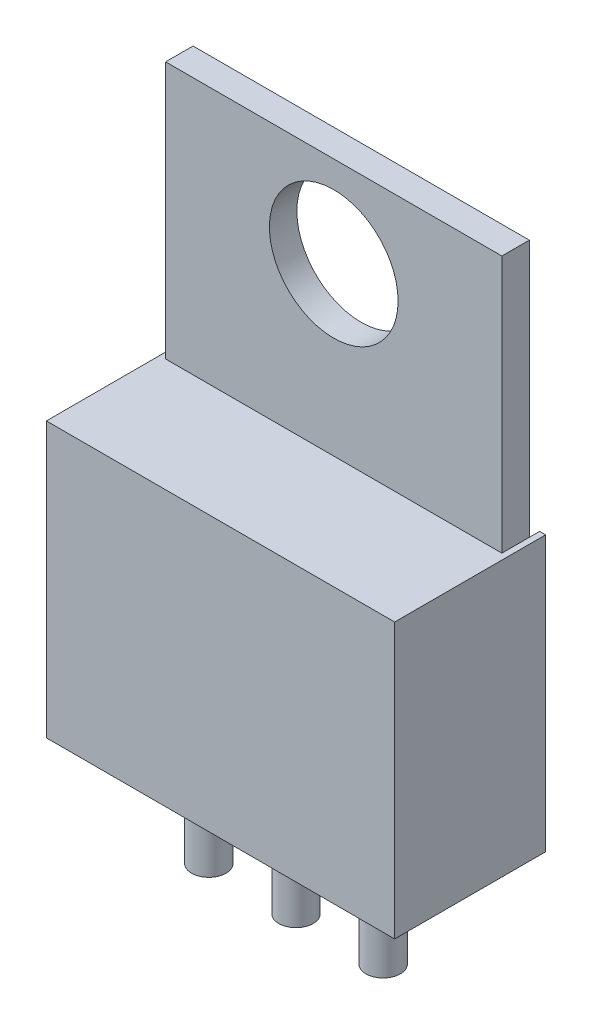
SolidWorks part; units mm, degrees
ref_plane "Face" through (0, 0, 0) normal (0, 0, 1) x (1, 0, 0)
ref_plane "Dessus" through (0, 0, 0) normal (0, 1, 0) x (1, 0, 0)
ref_plane "Droite" through (0, 0, 0) normal (1, 0, 0) x (0, 0, -1)
sketch "Esquisse1" plane through (0, 0, 0) normal (0, 0, 1) x (1, 0, 0)
  line L1 (0, 0) -> (10.15, 0)
  line L2 (0, 0) -> (0, 15.5)
  line L3 (0, 15.5) -> (10.15, 15.5)
  line L4 (10.15, 0) -> (10.15, 15.5)
  dimension "D1" = 10.15
  dimension "D2" = 15.5
extrude "Extrusion1" add sketch "Esquisse1" along normal blind 1.1
sketch "Esquisse2" plane through (0, 0, 1.1) normal (0, 0, 1) x (1, 0, 0)
  line L0 (5.075, 15.5) -> (5.075, 0) construction
  line L1 (10.15, 15.5) -> (0, 15.5) construction
  line L2 (0, 0) -> (10.15, 0) construction
  circle A0 centre (5.075, 12.85) radius 1.875
  dimension "D1" = 3.75
  dimension "D2" = 2.65
extrude "Enlèv. mat.-Extru.1" cut sketch "Esquisse2" against normal through all
sketch "Esquisse3" plane through (0, 0, 1.1) normal (0, 0, 1) x (1, 0, 0)
  line L0 (10.15, 0) -> (10.15, 15.5) construction
  line L1 (0, 0) -> (10.15, 0)
  line L2 (0, 0) -> (0, 8)
  line L3 (0, 8) -> (10.15, 8)
  line L4 (10.15, 0) -> (10.15, 8)
  dimension "D1" = 8
extrude "Extrusion2" add sketch "Esquisse3" along normal blind 3.3
sketch "Esquisse5" plane through (0, 0, 0) normal (0, -1, 0) x (1, 0, 0)
  line L0 (10.15, 2.2) -> (0, 2.2) construction
  line L1 (10.15, 4.4) -> (10.15, 0) construction
  line L2 (0, 4.4) -> (0, 0) construction
  line L3 (5.075, 4.4) -> (5.075, 0) construction
  line L4 (0, 4.4) -> (10.15, 4.4) construction
  line L5 (0, 0) -> (10.15, 0) construction
  circle A0 centre (5.075, 2.2) radius 0.5
  circle A1 centre (7.615, 2.2) radius 0.5
  circle A2 centre (2.535, 2.2) radius 0.5
  dimension "D1" = 1
  dimension "D2" = 2.54
extrude "Extrusion3" add sketch "Esquisse5" along normal blind 3
sketch "Esquisse6" plane through (0, 0, 1.1) normal (0, 0, 1) x (1, 0, 0)
  line L0 (5.075, 16.851) -> (5.075, 9.6089) construction
  line L1 (9.975, 16.851) -> (9.975, 7.6515) construction
  line L2 (10.15, 15.7288) -> (10.15, 7.5471) construction
  line L3 (10.15, 0) -> (10.15, 8) construction
  line L4 (10.4233, 8) -> (8.5834, 8) construction
  line L5 (10.15, 8) -> (0, 8) construction
  line L6 (10.2928, 15.5) -> (8.8966, 15.5) construction
  line L7 (10.15, 15.5) -> (0, 15.5) construction
  line L8 (0.175, 8) -> (0, 8)
  line L9 (9.975, 15.5) -> (10.15, 15.5)
  line L10 (9.975, 15.5) -> (9.975, 8)
  line L11 (9.975, 8) -> (10.15, 8)
  line L12 (10.15, 15.5) -> (10.15, 8)
  line L13 (0, 15.5) -> (0, 8)
  line L14 (0.175, 15.5) -> (0, 15.5)
  line L15 (0.175, 15.5) -> (0.175, 8)
  dimension "D1" = 4.9
extrude "Enlèv. mat.-Extru.2" cut sketch "Esquisse6" against normal blind 1.2
sketch "Esquisse7" plane through (0, 0, 0) normal (0, 0, -1) x (-1, 0, 0)
  line L0 (-5.075, 16.192) -> (-5.075, -1.643) construction
  line L1 (-10.6164, 15.5) -> (0.4664, 15.5) construction
  line L2 (-9.975, 15.5) -> (-0.175, 15.5) construction
  line L3 (-9.975, 16.192) -> (-9.975, 1.5235) construction
  line L4 (-10.6164, 0) -> (2.3757, 0) construction
  line L5 (-10.6164, 2) -> (2.3757, 2) construction
  line L6 (-10.6164, 8) -> (1.0252, 8) construction
  line L7 (1.0252, 7) -> (-10.6164, 7) construction
  line L8 (-6.95, 12.85) -> (-6.95, 6.5294) construction
  line L9 (-0.175, 1.5235) -> (-0.175, 16.4714) construction
  line L10 (-3.2, 8) -> (-6.95, 8)
  line L11 (-9.975, 15.5) -> (-0.175, 15.5)
  line L12 (-9.975, 15.5) -> (-9.975, 2)
  line L13 (-9.975, 2) -> (-0.175, 2)
  line L14 (-0.175, 15.5) -> (-0.175, 2)
  line L15 (-6.95, 8) -> (-6.95, 7)
  line L16 (-6.95, 7) -> (-3.2, 7)
  line L17 (-3.2, 8) -> (-3.2, 7)
  circle A0 centre (-5.075, 12.85) radius 1.875 construction
  dimension "D1" = 2
  dimension "D2" = 1
extrude "Enlèv. mat.-Extru.4" cut sketch "Esquisse7" against normal blind 0.3
